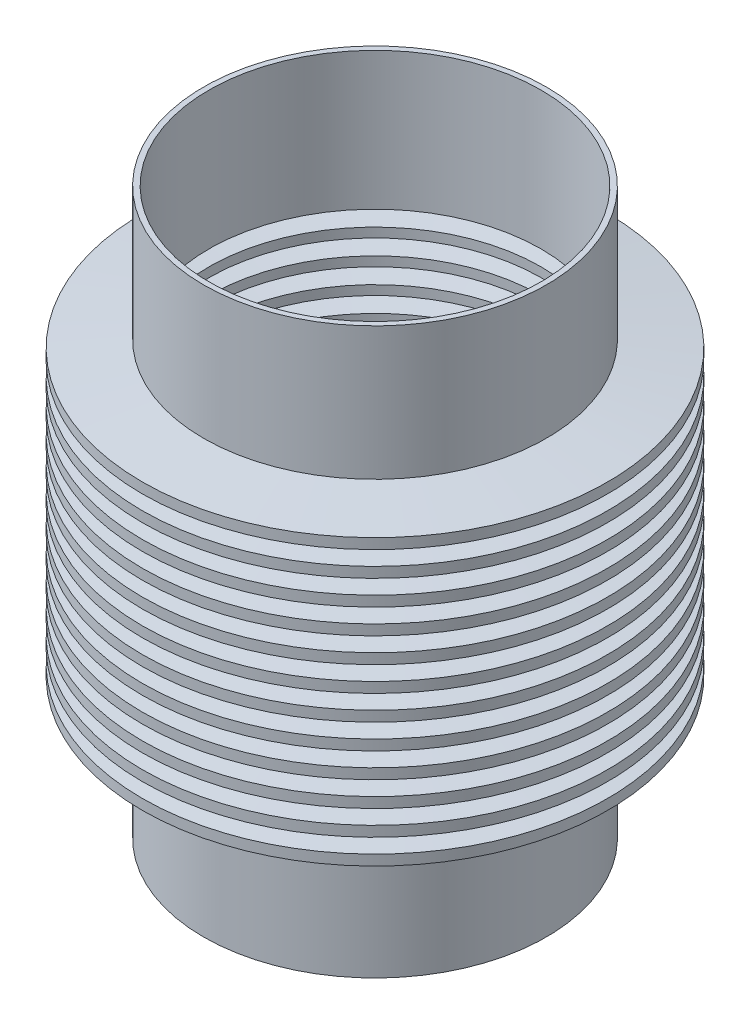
SolidWorks part; units mm, degrees
ref_plane "Front Plane" through (0, 0, 0) normal (0, 0, 1) x (1, 0, 0)
ref_plane "Top Plane" through (0, 0, 0) normal (0, 1, 0) x (1, 0, 0)
ref_plane "Right Plane" through (0, 0, 0) normal (1, 0, 0) x (0, 0, -1)
sketch "Sketch1" plane through (0, 0, 0) normal (0, 0, 1) x (1, 0, 0)
  line L0 (0, 0) -> (0, 92.7377) construction
  line L1 (-32.766, 0) -> (-31.75, 0)
  line L2 (-32.766, 44.45) -> (-6.7779, 44.45) construction
  line L3 (-44.1765, 61.1187) -> (-109.151, 61.1187) construction
  line L4 (-32.766, 0) -> (-32.766, 25.4)
  line L5 (-32.766, 25.4) -> (-44.45, 26.7906)
  line L6 (-31.75, 26.3022) -> (-31.75, 0)
  line L7 (-31.75, 26.3022) -> (-44.1765, 27.7812)
  line L8 (-31.75, 29.2603) -> (-44.1765, 27.7812)
  line L9 (-32.766, 30.1625) -> (-44.45, 28.7719)
  line L10 (-32.766, 30.1625) -> (-78.6383, 30.1625) construction
  line L11 (-44.45, 31.5531) -> (-44.45, 33.5344)
  line L12 (-32.766, 34.925) -> (-44.45, 33.5344)
  line L13 (-31.75, 34.0228) -> (-44.1765, 32.5437)
  line L14 (-44.1765, 32.5437) -> (-109.151, 32.5437) construction
  line L15 (-31.75, 31.0647) -> (-44.1765, 32.5437)
  line L16 (-32.766, 30.1625) -> (-44.45, 31.5531)
  line L17 (-32.766, 34.925) -> (-64.4427, 34.925) construction
  line L18 (-44.45, 28.7719) -> (-44.45, 26.7906)
  line L19 (-31.75, 38.7853) -> (-31.75, 40.5897)
  line L20 (-44.45, 38.2969) -> (-44.45, 36.3156)
  line L21 (-32.766, 39.6875) -> (-44.45, 38.2969)
  line L22 (-31.75, 38.7853) -> (-44.1765, 37.3063)
  line L23 (-31.75, 35.8272) -> (-44.1765, 37.3063)
  line L24 (-32.766, 34.925) -> (-44.45, 36.3156)
  line L25 (-31.75, 31.0647) -> (-31.75, 29.2603)
  line L26 (-32.766, 39.6875) -> (-64.2974, 39.6875) construction
  line L27 (-32.766, 49.2125) -> (-64.2974, 49.2125) construction
  line L28 (-32.766, 53.975) -> (-64.4427, 53.975) construction
  line L29 (-44.1765, 56.3563) -> (-109.151, 56.3562) construction
  line L31 (-31.75, 43.5478) -> (-44.1765, 42.0687)
  line L32 (-44.1765, 27.7812) -> (-109.151, 27.7812) construction
  line L33 (-31.75, 40.5897) -> (-44.1765, 42.0687)
  line L34 (-44.45, 41.0781) -> (-44.45, 43.0594)
  line L35 (-32.766, 44.45) -> (-44.45, 43.0594)
  line L36 (-32.766, 39.6875) -> (-44.45, 41.0781)
  line L37 (-31.75, 35.8272) -> (-31.75, 34.0228)
  line L38 (-32.766, 58.7375) -> (-78.6383, 58.7375) construction
  line L39 (-31.75, 53.0728) -> (-31.75, 54.8772)
  line L40 (-32.766, 49.2125) -> (-44.45, 47.8219)
  line L41 (-32.766, 44.45) -> (-44.45, 45.8406)
  line L42 (-44.45, 47.8219) -> (-44.45, 45.8406)
  line L43 (-31.75, 48.3103) -> (-44.1765, 46.8313)
  line L44 (-31.75, 45.3522) -> (-44.1765, 46.8313)
  line L45 (-31.75, 57.8353) -> (-31.75, 59.6397)
  line L46 (-32.766, 53.975) -> (-44.45, 52.5844)
  line L47 (-31.75, 53.0728) -> (-44.1765, 51.5937)
  line L48 (-31.75, 50.1147) -> (-44.1765, 51.5937)
  line L49 (-32.766, 49.2125) -> (-44.45, 50.6031)
  line L50 (-44.45, 50.6031) -> (-44.45, 52.5844)
  line L51 (-31.75, 50.1147) -> (-31.75, 48.3103)
  line L52 (-44.45, 60.1281) -> (-44.45, 62.1094)
  line L53 (-32.766, 58.7375) -> (-44.45, 57.3469)
  line L54 (-31.75, 57.8353) -> (-44.1765, 56.3563)
  line L55 (-31.75, 54.8772) -> (-44.1765, 56.3563)
  line L56 (-32.766, 53.975) -> (-44.45, 55.3656)
  line L57 (-44.45, 57.3469) -> (-44.45, 55.3656)
  line L58 (-32.766, 58.7375) -> (-44.45, 60.1281)
  line L59 (-31.75, 59.6397) -> (-44.1765, 61.1187)
  line L60 (-31.75, 62.5978) -> (-44.1765, 61.1187)
  line L61 (-32.766, 63.5) -> (-44.45, 62.1094)
  line L62 (-32.766, 63.5) -> (-18.9107, 63.5) construction
  line L63 (-32.766, 68.2625) -> (-78.6383, 68.2625) construction
  line L64 (-44.1765, 70.6437) -> (-109.151, 70.6438) construction
  line L65 (-32.766, 73.025) -> (-64.4427, 73.025) construction
  line L66 (-32.766, 77.7875) -> (-64.2974, 77.7875) construction
  line L67 (-44.1765, 65.8813) -> (-109.151, 65.8813) construction
  line L68 (-32.766, 63.5) -> (-44.45, 64.8906)
  line L69 (-31.75, 64.4022) -> (-44.1765, 65.8813)
  line L70 (-31.75, 67.3603) -> (-44.1765, 65.8813)
  line L71 (-32.766, 68.2625) -> (-44.45, 66.8719)
  line L72 (-44.45, 69.6531) -> (-44.45, 71.6344)
  line L73 (-32.766, 73.025) -> (-44.45, 71.6344)
  line L74 (-31.75, 72.1228) -> (-44.1765, 70.6437)
  line L75 (-31.75, 69.1647) -> (-44.1765, 70.6437)
  line L76 (-32.766, 68.2625) -> (-44.45, 69.6531)
  line L77 (-44.45, 66.8719) -> (-44.45, 64.8906)
  line L78 (-31.75, 76.8853) -> (-31.75, 78.6897)
  line L79 (-44.45, 76.3969) -> (-44.45, 74.4156)
  line L80 (-32.766, 77.7875) -> (-44.45, 76.3969)
  line L81 (-31.75, 76.8853) -> (-44.1765, 75.4063)
  line L82 (-31.75, 73.9272) -> (-44.1765, 75.4063)
  line L83 (-32.766, 73.025) -> (-44.45, 74.4156)
  line L84 (-31.75, 69.1647) -> (-31.75, 67.3603)
  line L85 (-31.75, 81.6478) -> (-44.1765, 80.1687)
  line L86 (-31.75, 78.6897) -> (-44.1765, 80.1687)
  line L87 (-44.45, 79.1781) -> (-44.45, 81.1594)
  line L88 (-32.766, 82.55) -> (-44.45, 81.1594)
  line L89 (-32.766, 77.7875) -> (-44.45, 79.1781)
  line L90 (-31.75, 73.9272) -> (-31.75, 72.1228)
  line L91 (-31.75, 64.4022) -> (-31.75, 62.5978)
  line L92 (-31.75, 45.3522) -> (-31.75, 43.5478)
  line L93 (-32.766, 82.55) -> (-32.766, 107.95)
  line L94 (-32.766, 107.95) -> (-31.75, 107.95)
  line L95 (-31.75, 107.95) -> (-31.75, 81.6478)
  dimension "D2" = 63.5
  dimension "D3" = 1.016
  dimension "D4" = 25.4
  dimension "D5" = 88.9
  dimension "D6" = 1.016
  dimension "D7" = 57.15
  dimension "D8" = 1.016
  dimension "D9" = 25.4
  dimension "D14" = 1.9812
revolve "Revolve1" add sketch "Sketch1" angle 360 about L0
sketch "Sketch10" [suppressed] plane through (0, 0, 0) normal (0, 0, 1) x (1, 0, 0)
  line L28 (-120, 72.7819) -> (-149.7538, 62.25)
  line L29 (-120, 74.2181) -> (-120, 72.7819)
  line L30 (-149.7538, 84.75) -> (-120, 74.2181)
  line L31 (-120, 95.2819) -> (-149.7538, 84.75)
  line L32 (-120, 102) -> (-120, 95.2819)
  line L33 (-120, 72.7819) -> (-149.7538, 62.25)
  line L34 (-120, 74.2181) -> (-120, 72.7819)
  line L35 (-149.7538, 84.75) -> (-120, 74.2181)
  line L36 (-120, 95.2819) -> (-149.7538, 84.75)
  line L37 (-120, 102) -> (-120, 95.2819)
  line L62 (-120, 29.2181) -> (-120, 27.7819)
  line L63 (-149.7538, 39.75) -> (-120, 29.2181)
  line L64 (-120, 50.2819) -> (-149.7538, 39.75)
  line L65 (-120, 51.7181) -> (-120, 50.2819)
  line L66 (-149.7538, 62.25) -> (-120, 51.7181)
  line L67 (-120, 29.2181) -> (-120, 27.7819)
  line L68 (-149.7538, 39.75) -> (-120, 29.2181)
  line L69 (-120, 50.2819) -> (-149.7538, 39.75)
  line L70 (-120, 51.7181) -> (-120, 50.2819)
  line L71 (-149.7538, 62.25) -> (-120, 51.7181)
  line L72 (-149.7538, 17.25) -> (-120, 6.7181)
  line L73 (-120, 27.7819) -> (-149.7538, 17.25)
  line L74 (-149.7538, 17.25) -> (-120, 6.7181)
  line L75 (-120, 27.7819) -> (-149.7538, 17.25)
  line L76 (-120, 0) -> (0, 0)
  line L77 (-120, 6.7181) -> (-120, 0)
  line L78 (-120, 6.7181) -> (-120, 0)
  line L79 (-150, 0) -> (150, 0) construction
  line L80 (0, 0) -> (0, 102)
  line L81 (150, 102) -> (-150, 102) construction
  line L82 (0, 102) -> (-120, 102)
  line L83 (0, 1.016) -> (0, 155.4378) construction
  line L84 (150, 1.016) -> (-150, 1.016) construction
  dimension "D1" = 0
  dimension "D2" = 0
  dimension "D3" = 0
  dimension "D4" = 0
